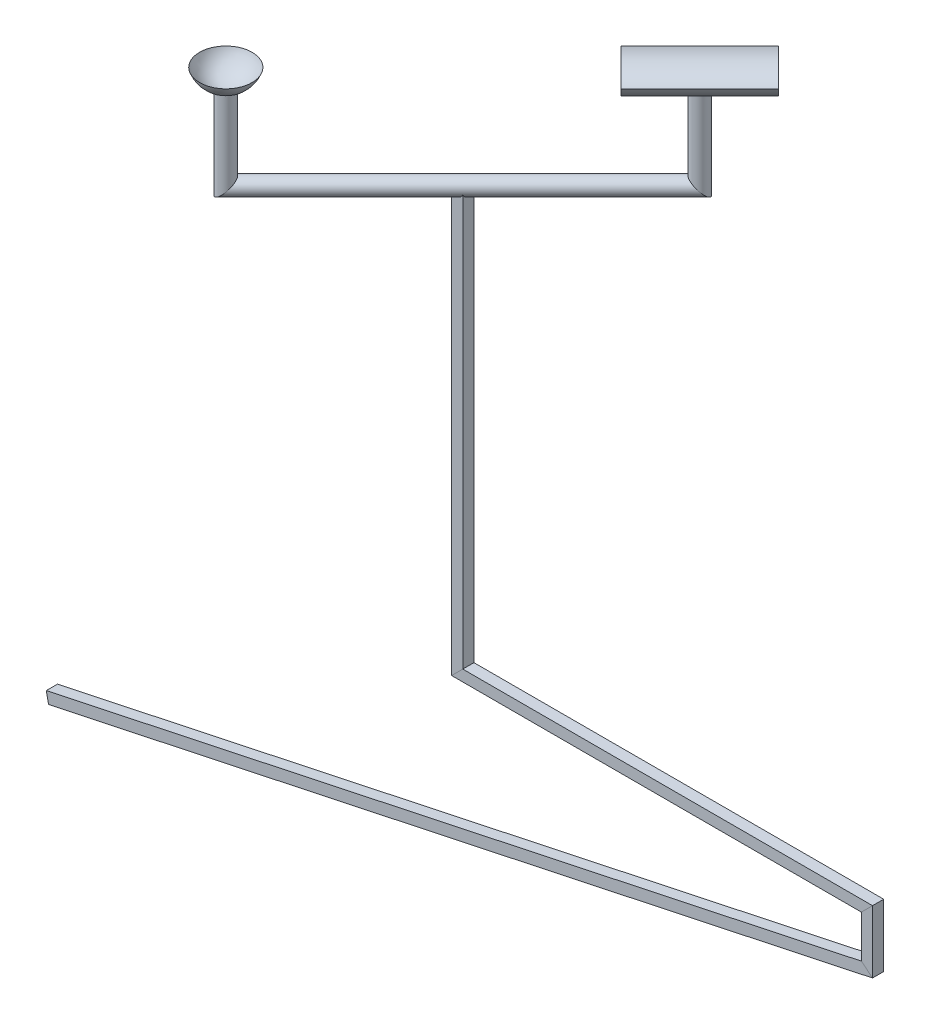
SolidWorks part; units mm, degrees
ref_plane "Plan de face" through (0, 0, 0) normal (0, 0, 1) x (1, 0, 0)
ref_plane "Plan de dessus" through (0, 0, 0) normal (0, 1, 0) x (1, 0, 0)
ref_plane "Plan de droite" through (0, 0, 0) normal (1, 0, 0) x (0, 0, -1)
sketch "Esquisse1" plane through (0, 0, 0) normal (0, 0, 1) x (1, 0, 0)
  line L0 (-146.7221, -31.1868) -> (146.7221, 31.1868)
  line L1 (146.7221, 31.1868) -> (146.7221, 50)
  line L2 (146.7221, 50) -> (0, 50)
  line L3 (0, 50) -> (0, 200)
  line L4 (0, 0) -> (-134.1587, 0) construction
  dimension "D1" = 300
  dimension "D2" = 12
  dimension "D3" = 50
  dimension "D4" = 150
ref_plane "Plan2" through (0, 200, 0) normal (0, 1, 0) x (-1, 0, 0)
sketch "Esquisse3" plane through (0, 200, 0) normal (0, 1, 0) x (-1, 0, 0)
  line L0 (2, -2) -> (-2, 2) construction
  line L1 (2, -2) -> (-2, -2)
  line L2 (2, -2) -> (2, 2)
  line L3 (2, 2) -> (-2, 2)
  line L4 (-2, -2) -> (-2, 2)
  dimension "D1" = 45
  dimension "D2" = 4
surface "Surface-Balayage1"
sketch "Esquisse4" plane through (0, 0, 0) normal (0, 0, 1) x (1, 0, 0)
  point P0 (0, 0)
ref_plane "Plan3" through (0, 200, 0) normal (0, 1, 0) x (-1, 0, 0)
sketch "Esquisse5" plane through (0, 200, 0) normal (0, 1, 0) x (-1, 0, 0)
  line L0 (-85.5285, -85.5285) -> (85.5285, 85.5285) construction
  line L1 (0, 0) -> (59.5113, 0) construction
  dimension "D1" = 45
ref_plane "Plan4" through (0, 0, 0) normal (-0.7071, 0, -0.7071) x (-0.7071, 0, 0.7071)
sketch "Esquisse6" plane through (0, 0, 0) normal (-0.7071, 0, -0.7071) x (-0.7071, 0, 0.7071)
  line L0 (60, 230) -> (60, 200)
  line L1 (60, 200) -> (-60, 200)
  line L2 (-60, 200) -> (-60, 230)
  dimension "D1" = 120
  dimension "D2" = 30
  dimension "D3" = 30
ref_plane "Plan5" through (0, 230, 0) normal (0, 1, 0) x (-1, 0, 0)
sketch "Esquisse7" plane through (0, 230, 0) normal (0, 1, 0) x (-1, 0, 0)
  circle A0 centre (-42.4264, -42.4264) radius 3
  dimension "D1" = 6
surface "Surface-Balayage2"
sketch "Esquisse8" plane through (0, 0, 0) normal (-0.7071, 0, -0.7071) x (-0.7071, 0, 0.7071)
  line L0 (-40, 230) -> (-80, 230)
  line L1 (-33.0523, 240) -> (-86.4426, 240) construction
  point P4 (-60, 230)
  dimension "D1" = 240
  dimension "D2" = 20
  dimension "D3" = 40
  dimension "D4" = 60
surface "Surface-Révolution1" sketch "Esquisse8" parameters "D1"=140
sketch "Esquisse9" plane through (0, 0, 0) normal (-0.7071, 0, -0.7071) x (-0.7071, 0, 0.7071)
  line L0 (60, 216.4131) -> (60, 263.5869) construction
  line L2 (60, 240) -> (69.3969, 236.5798) construction
  arc A0 (60, 230) -> (69.3969, 236.5798) centre (60, 240) ccw
  dimension "D1" = 20
  dimension "D2" = 60
  dimension "D3" = 240
  dimension "D4" = 70
surface "Surface-Révolution2" sketch "Esquisse9" parameters "D1"=360
sketch "Esquisse10" plane through (0, 0, 0) normal (-0.7071, 0, -0.7071) x (-0.7071, 0, 0.7071)
  line L0 (60, 240) -> (-80, 240) construction
  dimension "D1" = 60
  dimension "D2" = 240
  dimension "D3" = 140
